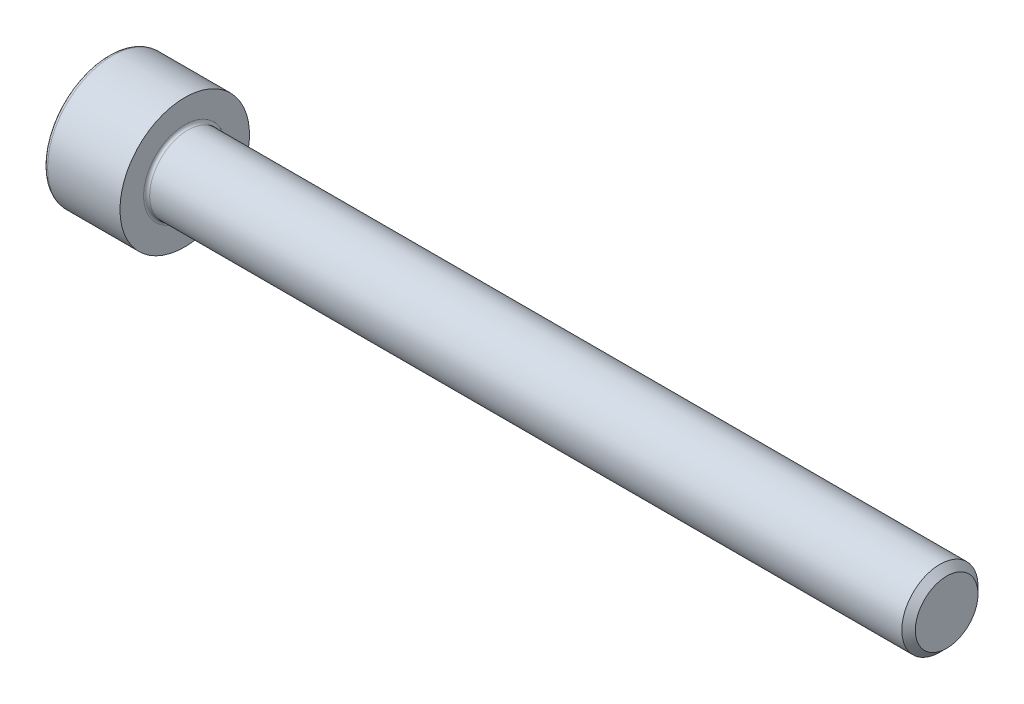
SolidWorks part; units mm, degrees
ref_plane "Plane1" through (0, 0, 0) normal (0, 0, 1) x (1, 0, 0)
ref_plane "Plane2" through (0, 0, 0) normal (0, 1, 0) x (1, 0, 0)
ref_plane "Plane3" through (0, 0, 0) normal (1, 0, 0) x (0, 0, -1)
sketch "BodySke" plane through (0, 0, 0) normal (0, 0, 1) x (1, 0, 0)
  line L0 (0, 0) -> (0, 4.25)
  line L1 (0, 4.25) -> (5, 4.25)
  line L2 (5, 4.25) -> (5, 2.5)
  line L3 (5, 2.5) -> (54.555, 2.5)
  line L4 (55, 2.055) -> (55, 0)
  line L5 (55, 0) -> (0, 0)
  line L6 (-31.75, 0) -> (127, 0) construction
  line L8 (55, 2.055) -> (54.555, 2.5)
  line L10 (55, -2.055) -> (54.555, -2.5) construction
  line L11 (5.8, 9.525) -> (5.8, 3.175) construction
  line L12 (33, 9.525) -> (33, 3.175) construction
  line L13 (-5, 9.525) -> (-5, 3.175) construction
  dimension "Diameter" = 5
  dimension "Head_ht" = 5
  dimension "Length" = 50
  dimension "Body_ch_ang" = 45
  dimension "Head_dia" = 8.5
  dimension "Minor_dia" = 4.11
  dimension "Advance" = 0.8
  dimension "Thread_nom" = 22
  dimension "Thread_length" = 60
revolve "Base-Revolve" add sketch "BodySke"
fillet "Fillet1" radius 0.2 1 edges at (5, 0, 2.5)
fillet "Fillet2" radius 0.25 1 edges at (0, 0, 4.25)
sketch "Sketch2" plane through (0, 0, 0) normal (0, 0, 1) x (1, 0, 0)
  line L0 (0, 2.042) -> (2.5, 2.042)
  line L1 (2.5, 2.042) -> (3.6789, 0)
  line L2 (-31.75, 0) -> (127, 0) construction
  line L3 (3.6789, 0) -> (0, 0)
  line L4 (0, 0) -> (0, 2.042)
  line L6 (0, 0) -> (47.625, 0) construction
  dimension "D1" = 2.042
  dimension "D2" = 60
  dimension "Depth" = 2.5
revolve "Hex-PreBroach" cut sketch "Sketch2" angle 360 about L6
sketch "Sketch3" plane through (0, 0, 0) normal (-1, 0, 0) x (0, 0.5, 0.866)
  line L0 (1.1789, 2.042) -> (-1.1789, 2.042)
  line L1 (-1.1789, 2.042) -> (-2.3579, 0)
  line L2 (1.1789, 2.042) -> (2.3579, 0)
  line L3 (1.1789, -2.042) -> (2.3579, 0)
  line L4 (1.1789, -2.042) -> (-1.1789, -2.042)
  line L5 (-1.1789, -2.042) -> (-2.3579, 0)
  dimension "D1" = 2.042
  dimension "D2" = 2.042
  dimension "Hex_size" = 4.084
extrude "Hex" cut sketch "Sketch3" against normal blind 2.5
sketch "ThdSchSke" plane through (0, 0, 0) normal (0, 0, 1) x (1, 0, 0)
  line L0 (33, -2.055) -> (32.6884, -2.5)
  line L1 (33, -2.055) -> (33.3116, -2.5)
  line L2 (33.3116, -2.5) -> (33.3116, -3.125)
  line L3 (-3.175, 0) -> (5.1513, 0) construction
  line L4 (0, 4) -> (0, -4) construction
  line L5 (33.3116, -3.125) -> (32.6884, -3.125)
  line L6 (32.6884, -3.125) -> (32.6884, -2.5)
  dimension "Thread_minor" = 4.11
  dimension "Diameter" = 5
  dimension "Start" = 33
  dimension "SideAngle" = 55
  dimension "VeeAngle" = 70
  dimension "Overcut" = 6.25
revolve "ThreadSchematic" [suppressed] cut sketch "ThdSchSke" angle 360 about L3
pattern_linear "ThdSchPat" [suppressed]
equation "\"D2@Sketch3\" = \"Hex_size@Sketch3\" / 2"
equation "\"D1@Sketch3\" = \"Hex_size@Sketch3\" / 2"
equation "\"D1@Sketch2\" = \"Hex_size@Sketch3\" / 2"
equation "\"Thread_minor@ThreadCosmetic\"  =  \"Minor_dia@BodySke\""
equation "\"Depth@Sketch2\" =  \"Key_eng@Hex\""
equation "\"Thread_length@ThreadCosmetic\" = ((sgn( (\"Length@BodySke\" - \"Advance@BodySke\" * 3.0) - \"Thread_nom@BodySke\" )-1)*( (\"Length@BodySke\" - \"Advance@BodySke\" * 3.0) - \"Thread_nom@BodySke\" ))/-2+ \"Thread_no"
equation "\"Thread_minor@ThdSchSke\" = \"Minor_dia@BodySke\""
equation "\"Diameter@ThdSchSke\" = \"Diameter@BodySke\""
equation "\"Overcut@ThdSchSke\" = \"Diameter@BodySke\" * 1.25"
equation "\"Start@ThdSchSke\" = \"Head_ht@BodySke\" + \"Length@BodySke\" - \"Thread_length@ThreadCosmetic\"  '---Non-countersunk---"
equation "\"Num_threads@ThdSchPat\" = int( \"Thread_length@ThreadCosmetic\" / \"Advance@BodySke\" + 0.999 )  + 1"
equation "\"Advance@ThdSchPat\" = \"Thread_length@ThreadCosmetic\" /  (\"Num_threads@ThdSchPat\" - 1) 'relax it"
equation "\"Num_threads@ThdSchPat\" = \"Num_threads@ThdSchPat\" - sgn( \"Num_threads@ThdSchPat\" - 1) '---chamfered tips only---"
